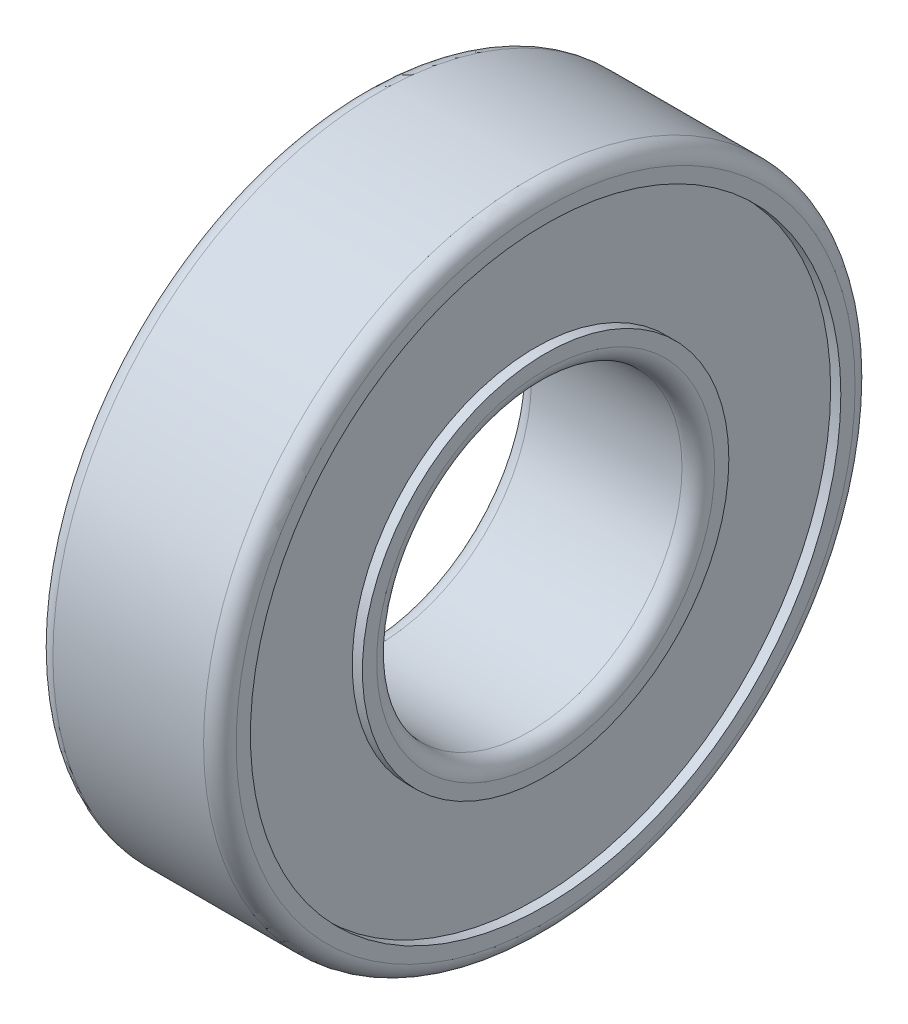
SolidWorks part; units mm, degrees
ref_plane "Спереди" through (0, 0, 0) normal (0, 0, 1) x (1, 0, 0)
ref_plane "Сверху" through (0, 0, 0) normal (0, 1, 0) x (1, 0, 0)
ref_plane "Справа" through (0, 0, 0) normal (1, 0, 0) x (0, 0, -1)
sketch "Эскиз1" plane through (0, 0, 0) normal (0, 0, 1) x (1, 0, 0)
  line L0 (0, 0) -> (-18.1184, 0) construction
  line L1 (0, 0) -> (0, 22.9845) construction
  line L2 (4.5, 7.5) -> (-4.5, 7.5)
  line L3 (-4.5, 7.5) -> (-4.5, 9)
  line L4 (-4, 9) -> (-4.5, 9)
  line L5 (-4, 9) -> (-4, 14.5)
  line L6 (-4, 14.5) -> (-4.5, 14.5)
  line L7 (-4.5, 14.5) -> (-4.5, 16)
  line L8 (-4.5, 16) -> (4.5, 16)
  line L9 (4.5, 14.5) -> (4.5, 16)
  line L10 (4, 14.5) -> (4.5, 14.5)
  line L11 (4, 9) -> (4, 14.5)
  line L12 (4, 9) -> (4.5, 9)
  line L13 (4.5, 7.5) -> (4.5, 9)
  point P13 (0, 16)
  point P18 (0, 7.5)
  dimension "D1" = 15
  dimension "D2" = 32
  dimension "D3" = 9
  dimension "D4" = 0.5
  dimension "D5" = 1.5
revolve "Повернуть1" add sketch "Эскиз1" angle 360 about L0
fillet "Скругление1" radius 0.8 4 edges at (4.5, 0, -16) (-4.5, 0, -16) (-4.5, 0, -7.5) (4.5, 0, -7.5)
